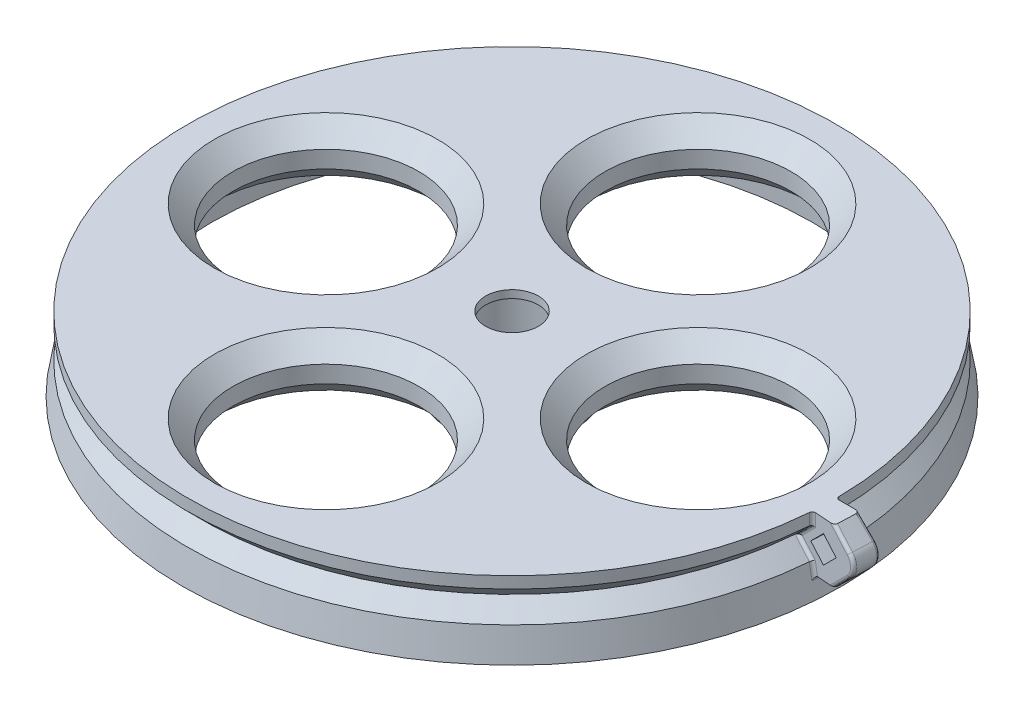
SolidWorks part; units mm, degrees
ref_plane "Front Plane" through (0, 0, 0) normal (0, 0, 1) x (1, 0, 0)
ref_plane "Top Plane" through (0, 0, 0) normal (0, 1, 0) x (1, 0, 0)
ref_plane "Right Plane" through (0, 0, 0) normal (1, 0, 0) x (0, 0, -1)
sketch "Sketch2" plane through (0, 0, 0) normal (1, 0, 0) x (0, 0, -1)
  line L0 (0, 0) -> (0, -50000) construction
sketch "Sketch1" plane through (0, 0, 0) normal (1, 0, 0) x (0, 0, -1)
  line L0 (-2.9, 1.75) -> (-2.9, -1.75)
  line L3 (-20.9, -1) -> (-19.9, 0)
  line L4 (-19.9, 0) -> (-20.9, 1)
  line L5 (-20.9, 1) -> (-20.9, 1.75)
  line L6 (-20.9, 1.75) -> (-2.9, 1.75)
  line L7 (-20.9, -1) -> (-20.9, 1) construction
  line L8 (0, 0) -> (-2.9, 0) construction
  line L10 (-20.9, -3) -> (-19.4, -3)
  line L11 (-19.4, -3) -> (-19.4, -1.75)
  line L12 (-19.4, -1.75) -> (-2.9, -1.75)
  line L13 (-20.9, -1) -> (-21.2527, -3)
  line L14 (-21.2527, -3) -> (-20.9, -3)
  dimension "D1" = 2.9
  dimension "D2" = 3.5
  dimension "D3" = 2
  dimension "D4" = 90
  dimension "D5" = 18
  dimension "D6" = 2
  dimension "D7" = 0.75
  dimension "D8" = 145
  dimension "D9" = 0.3527
  dimension "D10" = 1.5
revolve "Revolve1" add sketch "Sketch1" angle 360 about L0
sketch "Sketch3" plane through (0, 0, 0) normal (0, 0, 1) x (1, 0, 0)
  line L6 (20.9, 1.75) -> (22.4, 1.75)
  line L7 (20.9, 1.75) -> (-20.9, 1.75) construction
  line L8 (22.4, 1.75) -> (24.15, 0)
  line L9 (24.15, 0) -> (22.4, -1.75)
  line L26 (20.9, -1) -> (19.9, 0)
  line L27 (19.9, 0) -> (-19.9, 0) construction
  line L28 (19.9, 0) -> (20.9, 1)
  line L29 (20.9, 1) -> (-20.9, 1) construction
  line L30 (20.9, 1) -> (20.9, 1.75)
  line L31 (19.9, 0) -> (24.15, 0) construction
  line L32 (20.7661, 0) -> (21.65, 0.8839)
  line L33 (21.65, 0.8839) -> (22.5339, 0)
  line L34 (22.5339, 0) -> (21.65, -0.8839)
  line L35 (21.65, -0.8839) -> (20.7661, 0)
  line L36 (21.65, 1.75) -> (21.65, 0.8839) construction
  line L37 (21.65, -0.8839) -> (21.65, -1.75) construction
  line L39 (22.4, -1.75) -> (21.0322, -1.75)
  line L40 (21.2527, -3) -> (20.9, -1) construction
  line L41 (21.0322, -1.75) -> (20.9, -1)
  point P7 (19.9, 0)
  dimension "D1" = 1.25
  dimension "D2" = 1.5
  dimension "D3" = 1.3678
  dimension "D4" = 0.75
revolve "Revolve2" add sketch "Sketch3" angle 4 about L0
ref_plane "Plane1" through (0, -1.75, 0) normal (0, -1, 0) x (-1, 0, 0)
sketch "Sketch4" plane through (0, -1.75, 0) normal (0, -1, 0) x (-1, 0, 0)
  line L0 (0, 2.9) -> (0, 4.1) construction
  circle A0 centre (0, 0) radius 2.9
  circle A2 centre (0, 0) radius 4.1
  circle A3 centre (0, 0) radius 2.9 construction
  dimension "D1" = 1.2
extrude "Boss-Extrude1" add sketch "Sketch4" along normal blind 1
ref_plane "Plane2" through (0, 1.75, 0) normal (0, 1, 0) x (1, 0, 0)
sketch "Sketch5" plane through (0, 1.75, 0) normal (0, 1, 0) x (1, 0, 0)
  line L0 (0, 1.7) -> (0, 2.9) construction
  circle A0 centre (0, 0) radius 2.9
  circle A1 centre (0, 0) radius 2.9 construction
  circle A2 centre (0, 0) radius 1.7
  dimension "D1" = 3.4
extrude "Boss-Extrude2" add sketch "Sketch5" against normal blind 0.5
sketch "Sketch10" plane through (0, 1.75, 0) normal (0, 1, 0) x (1, 0, 0)
  line L0 (0, 0) -> (0, -12) construction
  line L1 (-12, 0) -> (0, 0) construction
  line L2 (0, 0) -> (0, 12) construction
  line L3 (12, 0) -> (0, 0) construction
  circle A0 centre (0, -12) radius 6
  circle A1 centre (0, 12) radius 6
  circle A2 centre (12, 0) radius 6
  circle A3 centre (-12, 0) radius 6
  dimension "D1" = 12
  dimension "D2" = 12
extrude "Cut-Extrude1" cut sketch "Sketch10" against normal through all
chamfer "Chamfer1" distance 1.2 angle 45 8 edges at (-12, 1.75, 6) (0, 1.75, -6) (12, 1.75, 6) (0, 1.75, 18) (12, -1.75, -6) (0, -1.75, -18) (-12, -1.75, -6) (0, -1.75, 6)
fillet "Fillet1" radius 1 1 edges at (24.1353, 0, 0.8428)
fillet "Fillet2" radius 0.2 9 edges at (20.4, -0.5, 0) (20.4, 0.5, 0) (20.9, 1.375, 0) (20.8491, 1.375, 1.4579) (20.3503, 0.5, 1.423) (20.3503, -0.5, 1.423) (21.0194, -1.75, 0.734) (20.9661, -1.375, 0) (20.9151, -1.375, 1.4625)
fillet "Fillet3" radius 0.2 6 edges at (22.9214, -1.2286, 0) (23.7358, 0, 0) (22.8656, -1.2286, 1.5989) (22.8656, 1.2286, 1.5989) (22.9214, 1.2286, 0) (23.678, 0, 1.6557)
